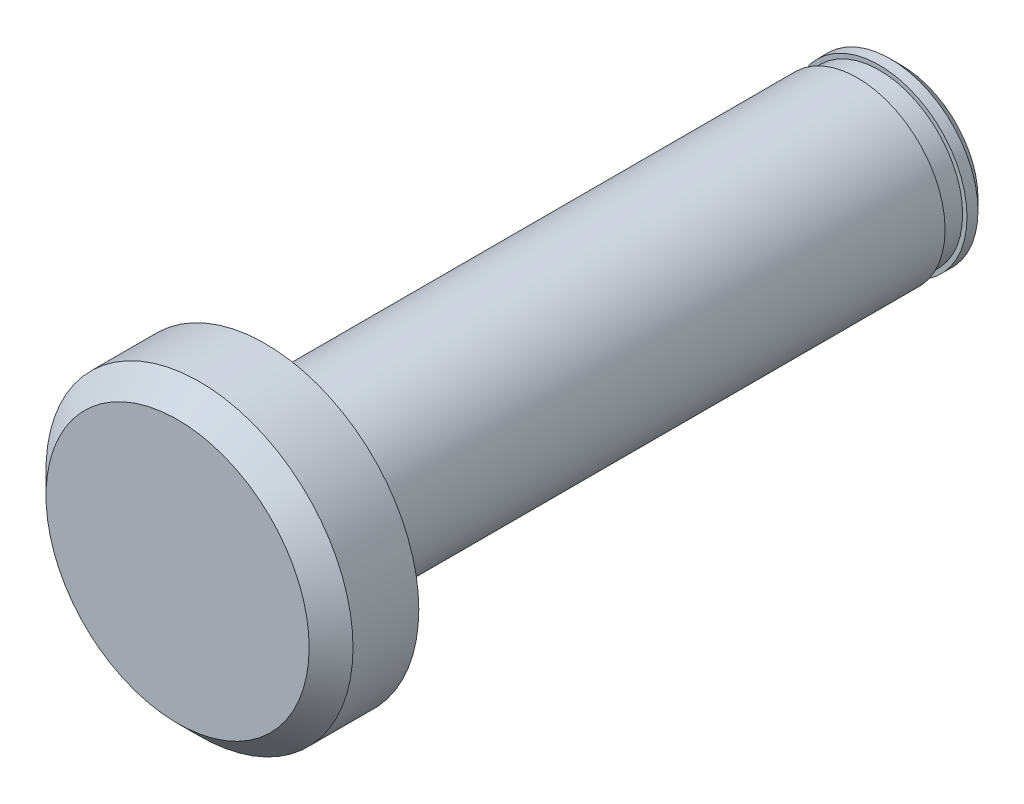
SolidWorks part; units mm, degrees
ref_plane "Plane1" through (0, 0, 0) normal (0, 0, 1) x (1, 0, 0)
ref_plane "Plane2" through (0, 0, 0) normal (0, 1, 0) x (1, 0, 0)
ref_plane "Plane3" through (0, 0, 0) normal (1, 0, 0) x (0, 0, -1)
sketch "Esquisse3" plane through (0, 0, 0) normal (0, 1, 0) x (1, 0, 0)
  line L0 (-14.4886, -38.9512) -> (-8.4886, -38.9512)
  line L1 (-8.4886, -38.9512) -> (-8.4886, -5.9512)
  line L2 (-8.4886, -5.9512) -> (-11.9886, -5.9512)
  line L3 (-11.9886, -5.9512) -> (-12.4886, -6.4512)
  line L4 (-12.4886, -6.4512) -> (-12.4886, -6.9512)
  line L5 (-12.4886, -34.9512) -> (-15.4886, -34.9512)
  line L6 (-15.4886, -34.9512) -> (-15.4886, -37.9512)
  line L7 (-14.4886, -38.9512) -> (-15.4886, -37.9512)
  line L8 (-8.4886, -56.2933) -> (-8.4886, 25.0735) construction
  line L9 (-12.4886, -6.9512) -> (-12.2886, -6.9512)
  line L10 (-12.2886, -6.9512) -> (-12.2886, -7.9512)
  line L11 (-12.4886, -7.9512) -> (-12.2886, -7.9512)
  line L12 (-12.4886, -7.9512) -> (-12.4886, -34.9512)
  dimension "D1" = 7
  dimension "D2" = 4
  dimension "D3" = 29
  dimension "D4" = 4
  dimension "D5" = 225
  dimension "D6" = 1
  dimension "D7" = 4
  dimension "D8" = 0.5
  dimension "D9" = 27
  dimension "D10" = 3.8
  dimension "D11" = 1
  dimension "D12" = 225
revolve "Base-Révolution" add sketch "Esquisse3" angle 360 about L8
